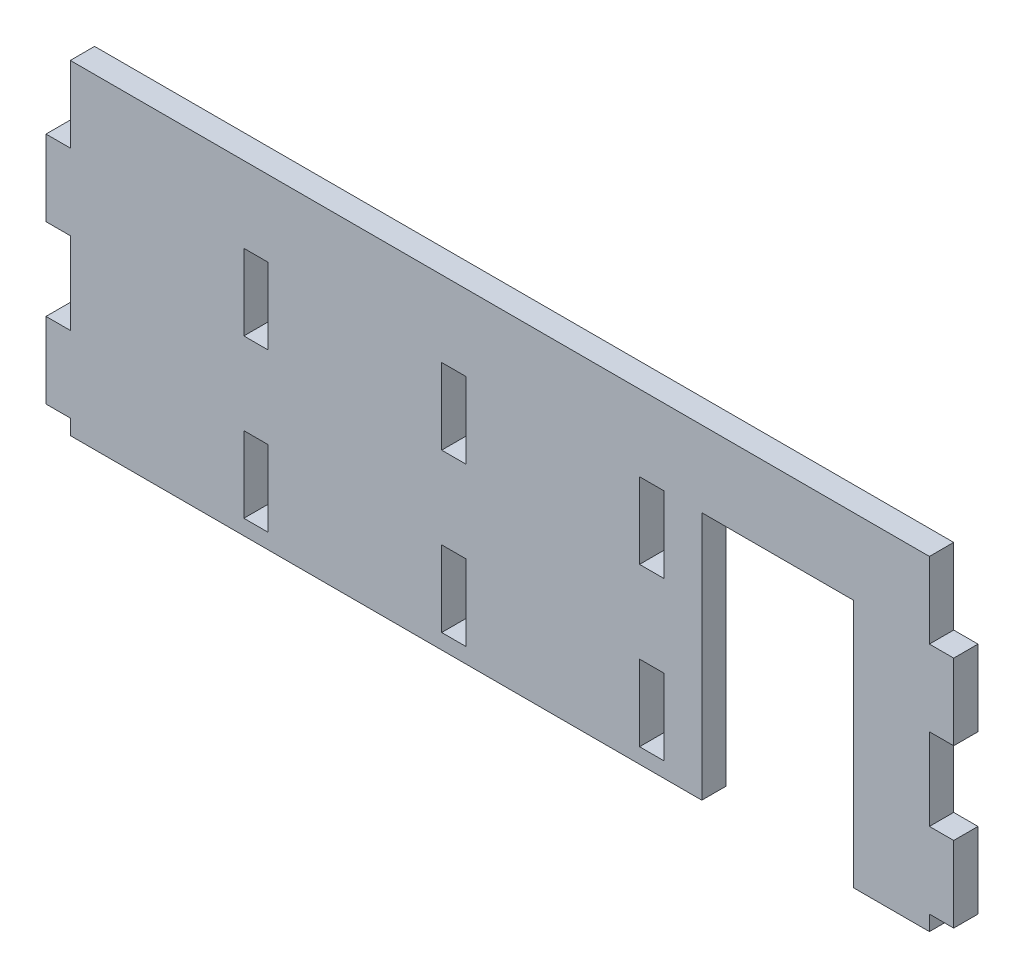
SolidWorks part; units mm, degrees
ref_plane "Front Plane" through (0, 0, 0) normal (0, 0, 1) x (1, 0, 0)
ref_plane "Top Plane" through (0, 0, 0) normal (0, 1, 0) x (1, 0, 0)
ref_plane "Right Plane" through (0, 0, 0) normal (1, 0, 0) x (0, 0, -1)
sketch "Sketch1" plane through (0, 0, 0) normal (0, 0, 1) x (1, 0, 0)
  line L0 (0, 127) -> (565.9, 127) construction
  line L1 (390.9, 50) -> (390.9, 100)
  line L2 (0, 254) -> (0, 40)
  line L3 (0, 254) -> (565.9, 254)
  line L4 (565.8, 40) -> (565.8, 254)
  line L5 (244.6, 204) -> (260.6, 204)
  line L6 (374.9, 100) -> (390.9, 100)
  line L7 (374.9, 50) -> (374.9, 100)
  line L8 (114.3, 204) -> (130.3, 204)
  line L9 (114.3, 204) -> (114.3, 154)
  line L10 (114.3, 154) -> (130.3, 154)
  line L11 (130.3, 204) -> (130.3, 154)
  line L12 (374.9, 50) -> (390.9, 50)
  line L13 (260.6, 50) -> (260.6, 100)
  line L14 (244.6, 100) -> (260.6, 100)
  line L15 (244.6, 50) -> (244.6, 100)
  line L16 (244.6, 204) -> (244.6, 154)
  line L17 (244.6, 154) -> (260.6, 154)
  line L18 (260.6, 204) -> (260.6, 154)
  line L19 (130.3, 50) -> (130.3, 100)
  line L20 (114.3, 100) -> (130.3, 100)
  line L21 (114.3, 50) -> (114.3, 100)
  line L22 (114.3, 50) -> (130.3, 50)
  line L23 (374.9, 204) -> (390.9, 204)
  line L24 (374.9, 204) -> (374.9, 154)
  line L25 (374.9, 154) -> (390.9, 154)
  line L26 (390.9, 204) -> (390.9, 154)
  line L27 (244.6, 50) -> (260.6, 50)
  line L28 (515.9, 204) -> (565.9, 204) construction
  line L30 (565.9, 40) -> (0, 40)
  line L32 (-16, 50) -> (-16, 100)
  line L33 (0, 204) -> (-16, 204)
  line L34 (0, 204) -> (0, 154)
  line L35 (0, 154) -> (-16, 154)
  line L36 (-16, 204) -> (-16, 154)
  line L37 (0, 100) -> (-16, 100)
  line L38 (0, 50) -> (0, 100)
  line L39 (0, 50) -> (-16, 50)
  line L41 (565.8, 50) -> (581.8, 50)
  line L42 (565.8, 50) -> (565.8, 100)
  line L43 (565.8, 100) -> (581.8, 100)
  line L44 (581.8, 204) -> (581.8, 154)
  line L45 (565.8, 154) -> (581.8, 154)
  line L46 (565.8, 204) -> (565.8, 154)
  line L47 (565.8, 204) -> (581.8, 204)
  line L48 (581.8, 50) -> (581.8, 100)
  line L49 (515.9, 50) -> (515.9, 40)
  line L50 (415.9, 204) -> (515.9, 204)
  line L51 (415.9, 204) -> (415.9, 40)
  line L53 (515.9, 204) -> (515.9, 50)
  point P6 (244.6, 179)
  point P7 (130.3, 179)
  point P8 (260.6, 179)
  point P9 (374.9, 179)
  point P36 (390.9, 179)
extrude "Boss-Extrude1" add sketch "Sketch1" along normal blind 16
equation "\"thk\"= 16mm"
equation "\"D5@Sketch1\"=\"thk\""
equation "\"D1@Boss-Extrude1\"=\"thk\""
equation "\"D9@Sketch1\"=\"thk\""
